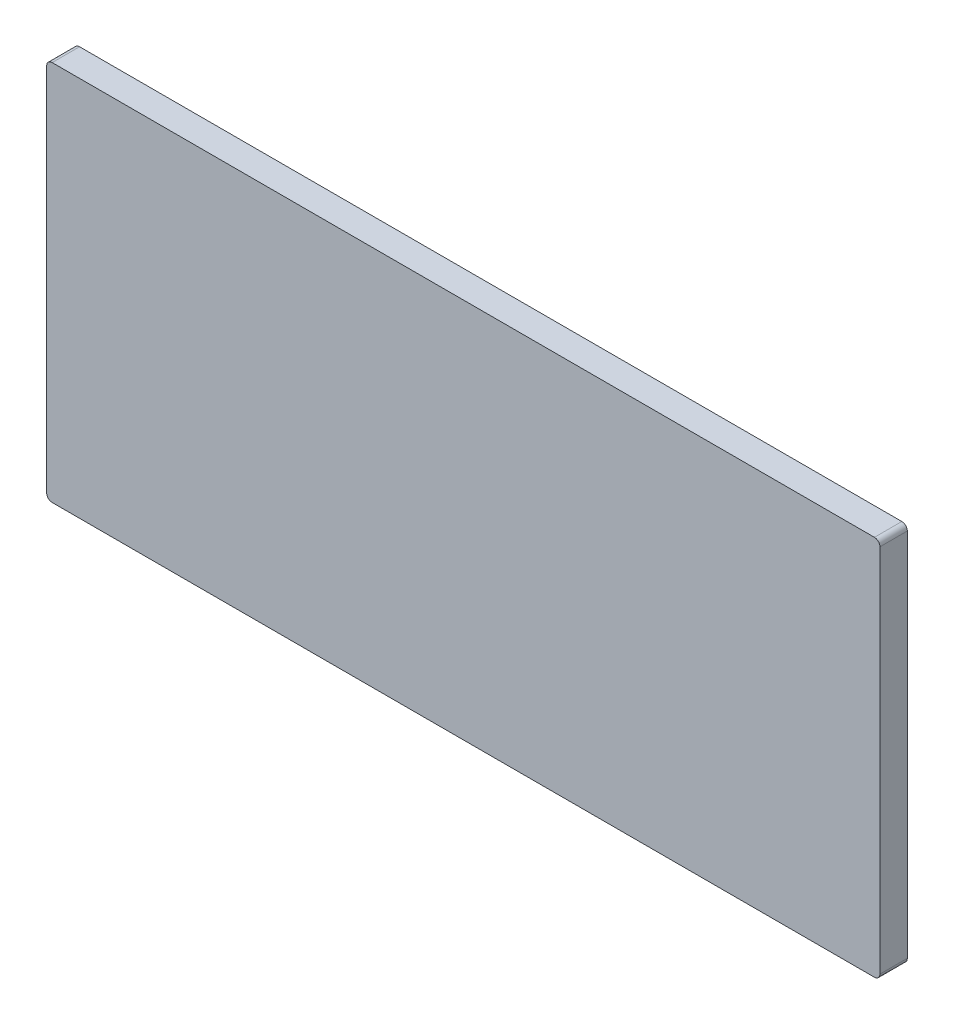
SolidWorks part; units mm, degrees
ref_plane "Plan de face" through (0, 0, 0) normal (0, 0, 1) x (1, 0, 0)
ref_plane "Plan de dessus" through (0, 0, 0) normal (0, 1, 0) x (1, 0, 0)
ref_plane "Plan de droite" through (0, 0, 0) normal (1, 0, 0) x (0, 0, -1)
sketch "Esquisse1" plane through (0, 0, 0) normal (0, 0, 1) x (1, 0, 0)
  line L1 (-27.8597, 108.4294) -> (272.1403, 108.4294)
  line L2 (-29.8597, 106.4294) -> (-29.8597, -28.5706)
  line L3 (-27.8597, -30.5706) -> (272.1403, -30.5706)
  line L4 (274.1403, 106.4294) -> (274.1403, -28.5706)
  arc A0 (-29.8597, -28.5706) -> (-27.8597, -30.5706) centre (-27.8597, -28.5706) ccw
  arc A1 (272.1403, -30.5706) -> (274.1403, -28.5706) centre (272.1403, -28.5706) ccw
  arc A2 (272.1403, 108.4294) -> (274.1403, 106.4294) centre (272.1403, 106.4294) cw
  arc A3 (-27.8597, 108.4294) -> (-29.8597, 106.4294) centre (-27.8597, 106.4294) ccw
  dimension "D3" = 2
  dimension "D1" = 304
  dimension "D2" = 139
extrude "Boss.-Extru.1" add sketch "Esquisse1" along normal blind 10
